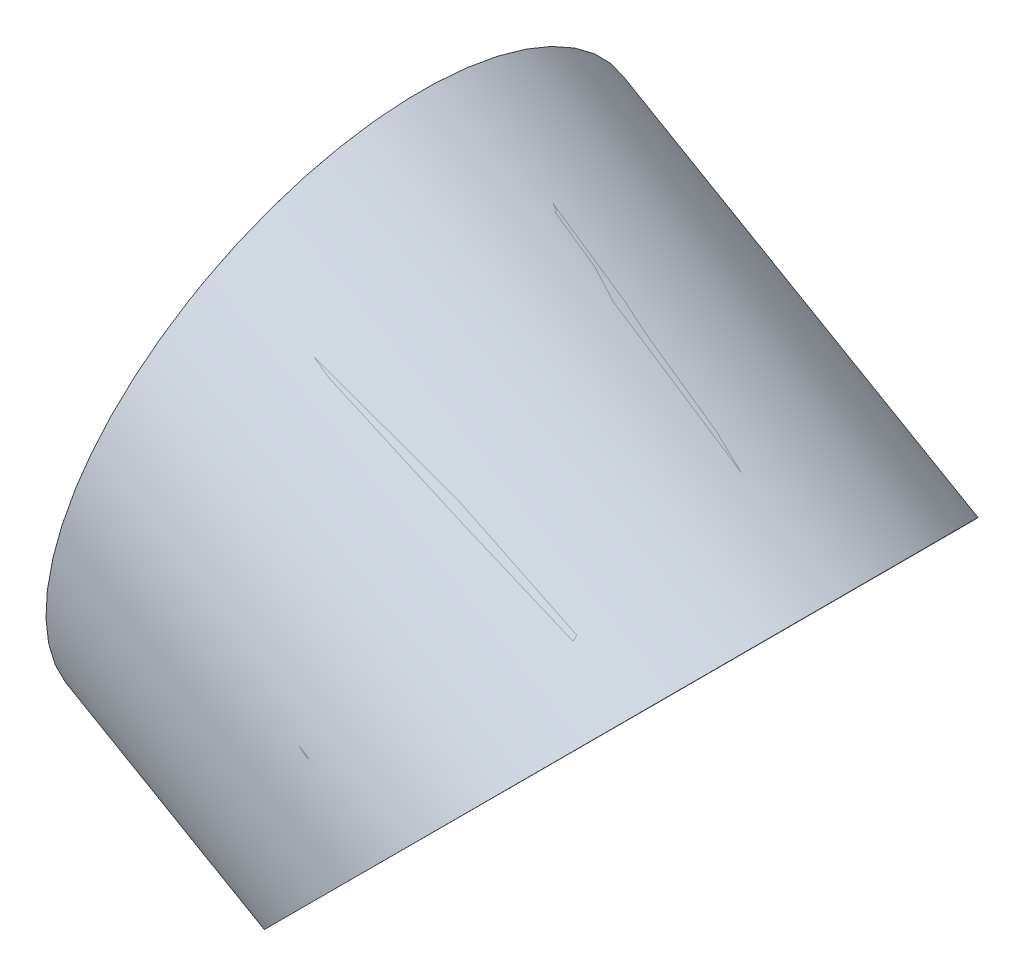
SolidWorks part; units mm, degrees
ref_plane "前视基准面" through (0, 0, 0) normal (0, 0, 1) x (1, 0, 0)
ref_plane "上视基准面" through (0, 0, 0) normal (0, 1, 0) x (1, 0, 0)
ref_plane "右视基准面" through (0, 0, 0) normal (1, 0, 0) x (0, 0, -1)
imported_body "基体零件-等径四节弯头-1"
sheet metal parameters "钣金1" parameters "D1"=0.7366, "厚度"=1
bend "圆角折弯1" bend radius 409 bend angle 359.86 parameters "D5"=1
flatten bends "展开-折弯1"
sketch "尖角-草图1" plane through (220.0002, 381.0514, 0.5) normal (-0.5, -0.866, 0.0012) x (0.866, -0.5, 0.0007)
  line L0 (-116.9934, 1284.4953) -> (118.802, 1284.3293) construction
  dimension "D1" = 0
process bends "加工-折弯1" parameters "D1"=0
sketch "平面-草图1" plane through (220.0002, 381.0514, 0.5) normal (-0.5, -0.866, 0.0012) x (0.866, -0.5, 0.0007)
